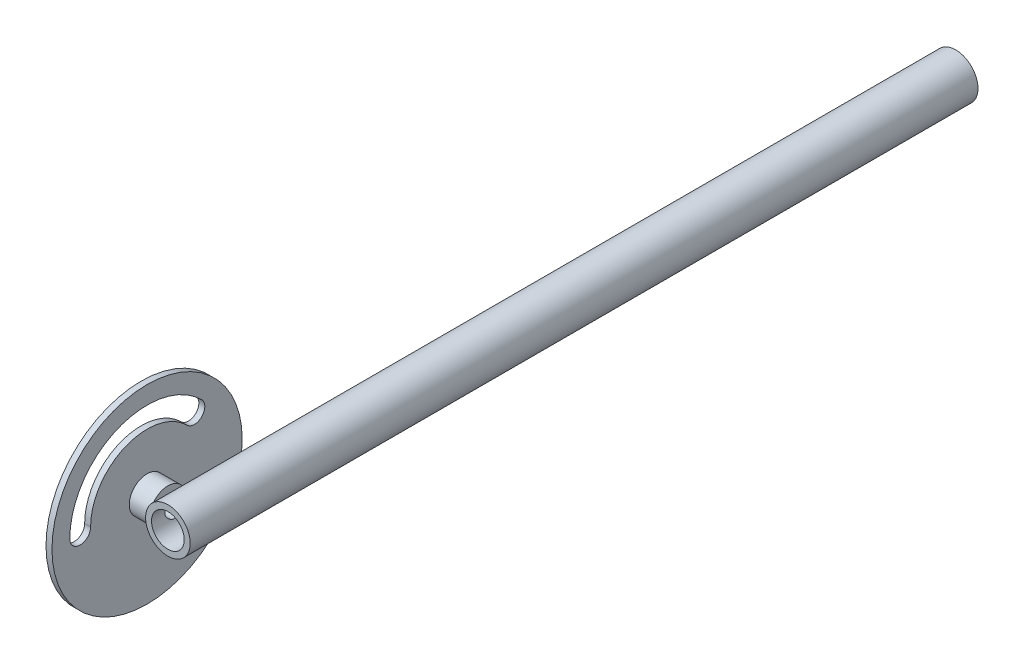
SolidWorks part; units mm, degrees
ref_plane "Plan de face" through (0, 0, 0) normal (0, 0, 1) x (1, 0, 0)
ref_plane "Plan de dessus" through (0, 0, 0) normal (0, 1, 0) x (1, 0, 0)
ref_plane "Plan de droite" through (0, 0, 0) normal (1, 0, 0) x (0, 0, -1)
ref_plane "Plan1" through (0, 0, -7) normal (0, 0, 1) x (1, 0, 0)
sketch "Esquisse1" plane through (0, 0, -7) normal (0, 0, 1) x (1, 0, 0)
  line L0 (-16, 32) -> (-16, 0)
  line L1 (-16, 0) -> (-14, 0)
  line L2 (-14, 0) -> (-14, 32)
  line L3 (-14, 32) -> (-16, 32)
  line L4 (-16, 0) -> (-14, 0) construction
revolve "Révolution1" add sketch "Esquisse1" angle 360 about L4
sketch "Esquisse2" plane through (-14, 0, 0) normal (1, 0, 0) x (0, 0, -1)
  arc A0 (25.3848, 18.3848) -> (-19, 0) centre (7, 0) ccw
  arc A1 (-19, 0) -> (-12, 0) centre (-15.5, 0) ccw
  arc A2 (-12, 0) -> (20.435, 13.435) centre (7, 0) cw
  arc A3 (20.435, 13.435) -> (25.3848, 18.3848) centre (22.9099, 15.9099) ccw
extrude "Enlèv. mat.-Extru.1" cut sketch "Esquisse2" against normal through all
sketch "Esquisse3" plane through (-14, 0, 0) normal (1, 0, 0) x (0, 0, -1)
  circle A0 centre (7, 0) radius 6
extrude "Boss.-Extru.1" add sketch "Esquisse3" along normal blind 7
sketch "Esquisse4" plane through (0, 0, 0) normal (0, 1, 0) x (1, 0, 0)
  line L0 (0, 0) -> (7.5, 0)
  line L1 (7.5, 0) -> (7.5, 265)
  line L2 (7.5, 265) -> (0, 265)
  line L3 (0, 265) -> (0, 0)
  line L4 (0, 265) -> (0, 0) construction
revolve "Révolution2" add sketch "Esquisse4" angle 360 about L4
hole_wizard "Diamètre du perçage Ø11.0 (11)1" positions "Esquisse6" profile "Esquisse5" hole size "Ø11.0" standard "Ansi Metric"
sketch "Esquisse6" plane through (0, 0, -265) normal (0, 0, -1) x (-1, 0, 0)
  point P0 (0, 0)
sketch "Esquisse5" plane through (0, 0, -265) normal (1, 0, 0) x (0, 1, 0)
  line L0 (0, 0) -> (0, 290)
  line L1 (0, 290) -> (5.5, 290)
  line L2 (5.5, 290) -> (5.5, 0)
  line L5 (5.5, 0) -> (0, 0)
  line L11 (0, -6.35) -> (0, 107.95) construction
  dimension "Diamètre du perçage jusqu'au prochain" = 11
  dimension "Profondeur du perçage jusqu'au prochain" = 290
hole_wizard "Diamètre du perçage Ø5.0 (5)1" positions "Esquisse8" profile "Esquisse7" hole size "Ø5.0" standard "Ansi Metric"
sketch "Esquisse8" plane through (-16, 0, 0) normal (-1, 0, 0) x (0, 0, 1)
  point P0 (-7, 0)
sketch "Esquisse7" plane through (-16, 0, -7) normal (0, 1, 0) x (0, 0, 1)
  line L0 (0, 0) -> (0, 10.5)
  line L1 (0, 10.5) -> (2.5, 10.5)
  line L2 (2.5, 10.5) -> (2.5, 0)
  line L5 (2.5, 0) -> (0, 0)
  line L11 (0, -6.35) -> (0, 107.95) construction
  dimension "Diamètre du perçage jusqu'au prochain" = 5
  dimension "Profondeur du perçage jusqu'au prochain" = 10.5
